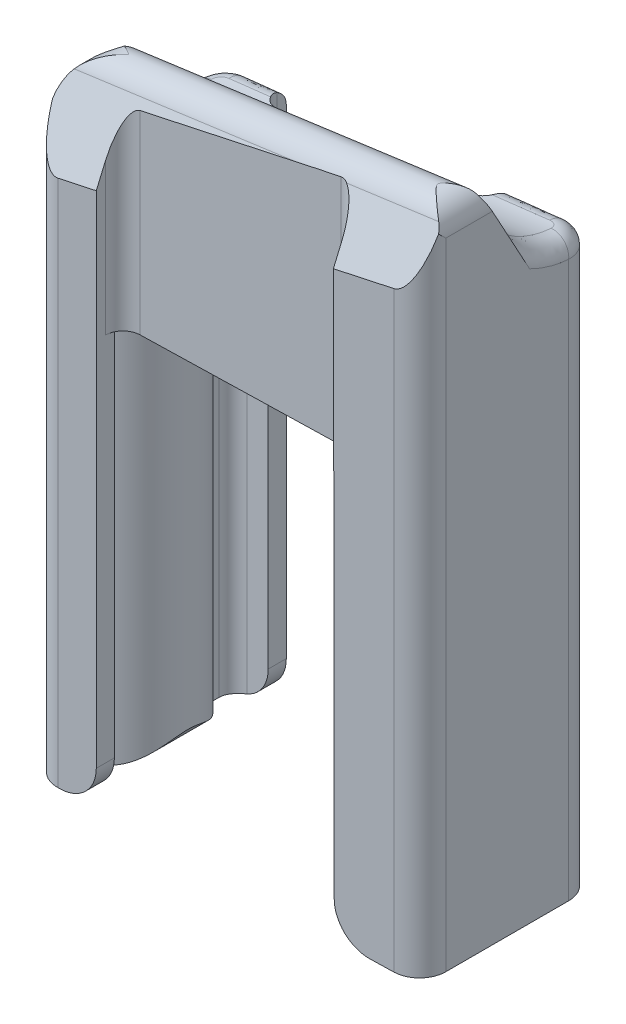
SolidWorks part; units mm, degrees
ref_plane "Front Plane" through (0, 0, 0) normal (0, 0, 1) x (1, 0, 0)
ref_plane "Top Plane" through (0, 0, 0) normal (0, 1, 0) x (1, 0, 0)
ref_plane "Right Plane" through (0, 0, 0) normal (1, 0, 0) x (0, 0, -1)
sketch "Sketch1" plane through (0, 0, 0) normal (0, 0, 1) x (1, 0, 0)
  line L0 (0, 0) -> (0, 51.4117)
  line L1 (4.1247, 56.1424) -> (31.9466, 59.9679)
  line L2 (34.544, 57.7032) -> (34.544, 0)
  line L3 (34.544, 0) -> (30.099, 0)
  line L4 (26.924, 3.175) -> (26.924, 36.83)
  line L5 (26.924, 36.83) -> (5.842, 36.83)
  line L6 (5.842, 36.83) -> (5.842, 3.175)
  line L7 (2.667, 0) -> (0, 0)
  arc A0 (0, 51.4117) -> (4.1247, 56.1424) centre (4.7752, 51.4117) cw
  arc A1 (31.9466, 59.9679) -> (34.544, 57.7032) centre (32.258, 57.7032) cw
  arc A2 (30.099, 0) -> (26.924, 3.175) centre (30.099, 3.175) cw
  arc A3 (5.842, 3.175) -> (2.667, 0) centre (2.667, 3.175) cw
  point P11 (0, 55.5752)
  point P14 (34.544, 60.325)
  dimension "D6" = 4.7752
  dimension "D7" = 2.286
  dimension "D8" = 3.175
  dimension "D1" = 55.5752
  dimension "D2" = 60.325
  dimension "D3" = 34.544
  dimension "D4" = 5.842
  dimension "D5" = 21.082
  dimension "D9" = 36.83
extrude "Boss-Extrude1" add sketch "Sketch1" against normal blind 17.5514
ref_plane "Plane1" through (0, 60.96, 0) normal (0, 1, 0) x (1, 0, 0)
sketch "Sketch3" plane through (0, 60.96, 0) normal (0, 1, 0) x (1, 0, 0)
  line L0 (34.544, 8.7757) -> (0, 8.7757) construction
  line L1 (34.544, 17.5514) -> (34.544, 0) construction
  line L2 (0, 17.5514) -> (0, 0) construction
  line L3 (0, 17.5514) -> (34.544, 16.683)
  line L4 (34.544, 16.683) -> (34.544, 17.5514)
  line L5 (34.544, 17.5514) -> (0, 17.5514)
  line L6 (0, 0) -> (34.544, 0.8684)
  line L7 (34.544, 0) -> (0, 0)
  line L8 (34.544, 0.8684) -> (34.544, 0)
  dimension "D1" = 1.44
extrude "Cut-Extrude1" cut sketch "Sketch3" against normal through all
sketch "Sketch4" plane through (0, 60.96, 0) normal (0, 1, 0) x (1, 0, 0)
  line L0 (34.544, 8.7757) -> (0, 8.7757) construction
  line L1 (34.544, 16.683) -> (34.544, 0.8684) construction
  line L2 (0, 17.5514) -> (0, 0) construction
  line L3 (26.8478, 16.8765) -> (26.8478, 16.1298)
  line L4 (4.1247, 17.4477) -> (31.9466, 16.7483) construction
  line L5 (25.2074, 14.5301) -> (7.402, 14.9777)
  line L6 (5.842, 16.5774) -> (5.842, 17.4045)
  line L7 (5.842, 17.4045) -> (26.8478, 16.8765)
  line L8 (5.842, 0.974) -> (5.842, 0.1469)
  line L9 (25.2074, 3.0213) -> (7.402, 2.5737)
  line L10 (5.842, 0.1469) -> (26.8478, 0.6749)
  line L11 (26.8478, 0.6749) -> (26.8478, 1.4216)
  arc A0 (26.8478, 16.1298) -> (25.2074, 14.5301) centre (25.2476, 16.1298) cw
  arc A1 (26.8478, 1.4216) -> (25.2074, 3.0213) centre (25.2476, 1.4216) ccw
  arc A2 (7.402, 14.9777) -> (5.842, 16.5774) centre (7.4422, 16.5774) cw
  arc A3 (7.402, 2.5737) -> (5.842, 0.974) centre (7.4422, 0.974) ccw
  point P14 (26.8478, 14.4889)
  point P23 (5.842, 15.0169)
  point P26 (5.842, 2.5345)
  dimension "D4" = 1.6002
  dimension "D5" = 1.6002
  dimension "D6" = 1.6002
  dimension "D1" = 7.6962
  dimension "D2" = 2.3876
  dimension "D3" = 5.842
extrude "Cut-Extrude2" cut sketch "Sketch4" against normal through all
sketch "Sketch6" plane through (0, 60.96, 0) normal (0, 1, 0) x (1, 0, 0)
  line L0 (34.544, 8.7757) -> (-50.4355, 8.7757) construction
  line L1 (34.544, 16.683) -> (34.544, 0.8684) construction
  line L4 (0, 17.5514) -> (0, 0) construction
  circle A0 centre (-1.6256, 8.7757) radius 5.588
  point P4 (3.9624, 8.7757)
  dimension "D1" = 11.176
  dimension "D2" = 3.9624
extrude "Cut-Extrude3" cut sketch "Sketch6" against normal through all
sketch "Sketch8" plane through (0, 0, 0) normal (-1, 0, 0) x (0, 0, 1)
  line L0 (-8.7757, 0) -> (-8.7757, 99.5268) construction
  line L1 (-16.7948, 0) -> (-0.7566, 0) construction
  line L2 (-4.8133, 0) -> (-4.8133, 94.9879) construction
  line L4 (-3.4294, 0) -> (0, 0) construction
  line L5 (-15.1257, 0) -> (-15.1257, 118.4648) construction
  line L6 (-17.5514, 0) -> (-14.122, 0) construction
  line L7 (-16.7483, 59.9679) -> (-0.8031, 59.9679) construction
  line L8 (-2.7813, 57.9359) -> (-0.0013, 52.1049)
  line L9 (-6.8453, 57.9359) -> (-8.6133, 55.4109)
  line L10 (-0.0013, 52.1049) -> (3.1622, 52.1049)
  line L11 (3.1622, 52.1049) -> (3.1622, 63.2346)
  line L12 (3.1622, 63.2346) -> (-7.8763, 63.2346)
  arc A0 (-2.7813, 57.9359) -> (-6.8453, 57.9359) centre (-4.8133, 57.9359) ccw
  arc A1 (-7.8763, 63.2346) -> (-8.6133, 55.4109) centre (-15.1257, 59.971) ccw
  ellipse E0 centre (-0.12, 51.4117) end of major axis (-0.12, 56.1869) minor radius 0.12 (0, 51.4117) -> (-0.1037, 56.1424) ccw construction
  point P14 (-4.8133, 59.9679)
  point P17 (-2.7813, 57.9359)
  point P18 (-6.8453, 57.9359)
  dimension "D3" = 4.064
  dimension "D5" = 15.9004
  dimension "D1" = 6.35
  dimension "D2" = 3.9624
  dimension "D6" = 35
sketch "Sketch10" plane through (-0.06, 0, -2.3861) normal (0.0251, 0, 0.9997) x (0.9997, 0, -0.0251)
  line L0 (7.4643, 56.593) -> (38.2037, 56.593) construction
  line L1 (7.4643, 56.593) -> (35.5322, 60.4593) construction
  line L2 (31.9567, 59.9679) -> (26.8563, 59.2668) construction
  dimension "D1" = 7.843
ref_plane "Plane2" through (0, 0, 0) normal (-0.9907, -0.1357, 0) x (0, 0, 1)
sketch "Sketch12" plane through (0, 0, 0) normal (-0.9907, -0.1357, 0) x (0, 0, 1)
  line L0 (-8.7757, -4.0849) -> (-8.7757, 114.6844) construction
  line L1 (-16.7948, -4.0849) -> (-0.7566, -4.0849) construction
  line L2 (-15.1257, -4.0849) -> (-15.1257, 114.6844) construction
  line L3 (-4.8133, -4.0849) -> (-4.8133, 114.6844) construction
  line L4 (-15.1257, 47.0068) -> (8.3903, 47.0068) construction
  line L5 (-2.9198, 53.7684) -> (0, 47.0212)
  line L6 (0, 50.936) -> (0, 0) construction
  line L8 (0, 47.0212) -> (2.8091, 47.0212)
  line L9 (2.8091, 47.0212) -> (2.8091, 66.2252)
  line L10 (2.8091, 66.2252) -> (-15.1257, 66.2252)
  line L11 (-15.1257, 66.2252) -> (-15.1257, 62.9072)
  line L12 (-17.4477, 55.0631) -> (-0.1037, 55.0631) construction
  line L13 (-8.1938, 51.0641) -> (-6.7068, 53.7684)
  line L14 (-6.7068, 53.7684) -> (5.2059, 53.7684) construction
  line L15 (0, 47.0212) -> (0, 64.7287) construction
  arc A1 (-15.1257, 62.9072) -> (-8.1938, 51.0641) centre (-15.1257, 54.957) ccw
  arc A3 (-2.9198, 53.7684) -> (-6.7068, 53.7684) centre (-4.8133, 53.0311) ccw
  point P12 (-4.8133, 55.0631)
  point P15 (-2.9198, 53.7684)
  point P25 (-2.9198, 53.7684)
  dimension "D3" = 4.064
  dimension "D6" = 15.9004
  dimension "D1" = 3.9624
  dimension "D2" = 6.35
  dimension "D4" = 23.4
extrude "Cut-Extrude7" cut sketch "Sketch12" against normal through all
sketch "Sketch16" plane through (0, 0, 0) normal (0, -1, 0) x (1, 0, 0)
  line L0 (3.9624, -8.7757) -> (34.544, -8.7757) construction
  line L1 (34.544, -16.683) -> (34.544, -0.8684) construction
  line L2 (34.544, -0.8684) -> (26.924, -0.6768) construction
  line L3 (26.924, -0.6768) -> (-6.444, 0.162) construction
  line L4 (33.02, -2.1005) -> (26.924, -1.9472)
  line L5 (26.924, -16.8746) -> (26.924, -0.6768) construction
  line L6 (26.924, -1.9472) -> (26.924, -15.6042)
  line L7 (33.02, -2.1005) -> (33.02, -15.4509)
  line L8 (33.02, -15.4509) -> (26.924, -15.6042)
  arc A0 (2.667, -12.3533) -> (2.667, -5.1981) centre (-1.6256, -8.7757) ccw construction
  point P19 (33.02, -8.7757)
  point P20 (26.924, -8.7757)
  dimension "D1" = 2.54
  dimension "D2" = 1.524
extrude "Cut-Extrude8" cut sketch "Sketch16" against normal up to surface (36.83 mm away)
fillet "Fillet11" radius 1.27 2 edges at (33.02, 18.415, -2.1005) (33.02, 18.415, -15.4509)
sketch "Sketch17" plane through (0, 0, 0) normal (0, -1, 0) x (1, 0, 0)
  line L0 (34.544, -8.7757) -> (-7.9604, -8.7757) construction
  line L1 (34.544, -16.683) -> (34.544, -0.8684) construction
  line L3 (2.667, -1.7907) -> (5.842, -1.7907)
  line L4 (5.842, -17.4045) -> (5.842, -0.1469) construction
  line L5 (5.842, -1.7907) -> (5.842, -15.7607)
  line L9 (2.667, -15.7607) -> (5.842, -15.7607)
  line L10 (2.667, -17.4844) -> (2.667, -12.3533) construction
  line L11 (2.667, -15.7607) -> (2.667, -13.6296)
  line L12 (2.667, -3.9218) -> (2.667, -1.7907)
  arc A0 (2.667, -13.6296) -> (2.667, -3.9218) centre (-0.1016, -8.7757) ccw
  arc A1 (2.667, -12.3533) -> (2.667, -5.1981) centre (-1.6256, -8.7757) ccw construction
  point P6 (3.9624, -8.7757)
  point P7 (5.4864, -8.7757)
  point P17 (5.842, -8.7757)
  point P23 (4.2545, -1.7907)
  dimension "D1" = 13.97
  dimension "D3" = 5.588
  dimension "D2" = 1.524
extrude "Cut-Extrude9" cut sketch "Sketch17" against normal up to surface (36.83 mm away)
fillet "Fillet8" radius 2.3876 4 edges at (0, 23.7302, 0) (0, 23.9142, -17.5514) (34.544, 26.1666, -16.683) (34.544, 27.1088, -0.8684)
fillet "Fillet9" radius 1.524 6 edges at (0, 47.4625, -14.6115) (0.9583, 47.807, -17.0155) (34.544, 53.4817, -10.7813) (34.0291, 52.1392, -15.8357) (4.1433, 48.363, -17.4472) (29.5296, 51.6727, -16.8091)
sketch "Sketch18" plane through (0, 0, 0) normal (0, 1, 0) x (1, 0, 0)
  line L0 (3.9624, 8.7757) -> (41.3791, 8.7757) construction
  line L1 (5.842, 17.4045) -> (26.8478, 16.8765) construction
  line L2 (5.842, 0.1469) -> (26.8478, 0.6749) construction
  arc A0 (3.932, 8.1938) -> (1.3214, 13.5234) centre (-1.6256, 8.7757) ccw construction
  dimension "D1" = 1.44
  dimension "D2" = 1.44
fillet "Fillet12" radius 1.27 2 edges at (2.667, 18.415, -15.7607) (2.667, 18.415, -1.7907)
